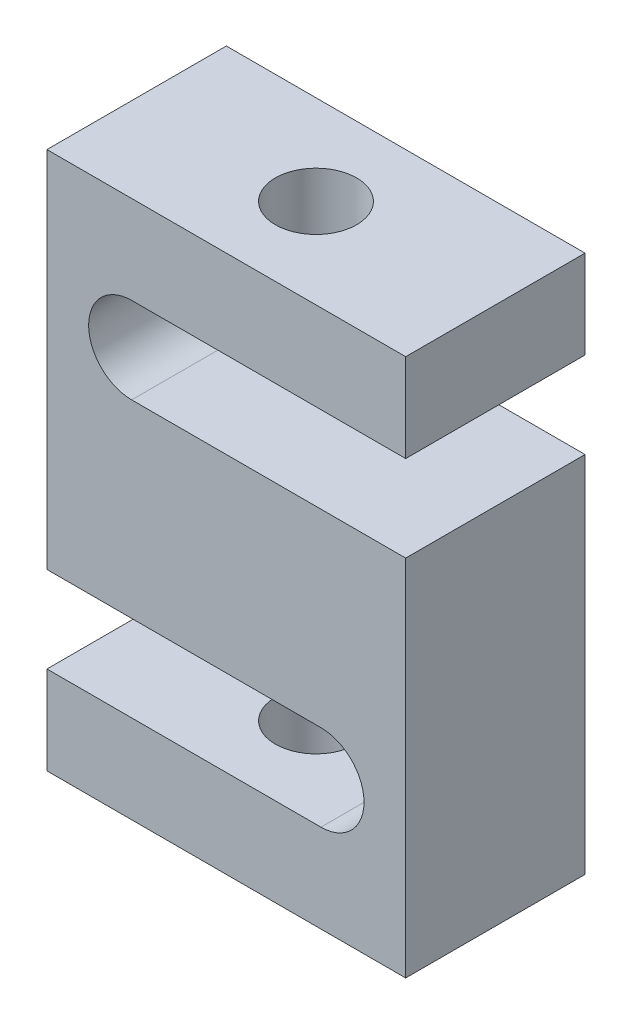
SolidWorks part; units mm, degrees
ref_plane "Front" through (0, 0, 0) normal (0, 0, 1) x (1, 0, 0)
ref_plane "Top" through (0, 0, 0) normal (0, 1, 0) x (1, 0, 0)
ref_plane "Right" through (0, 0, 0) normal (1, 0, 0) x (0, 0, -1)
sketch "Sketch2" plane through (0, 0, 0) normal (0, 0, 1) x (1, 0, 0)
  line L0 (-115.7484, 0) -> (180.4341, 0) construction
  line L1 (-25.4, 38.1) -> (25.4, 38.1)
  line L2 (-25.4, 38.1) -> (-25.4, -13.4)
  line L3 (-25.4, -38.1) -> (25.4, -38.1)
  line L4 (25.4, 38.1) -> (25.4, 25.6)
  line L5 (-25.4, 38.1) -> (25.4, -38.1) construction
  line L6 (-25.4, -38.1) -> (25.4, 38.1) construction
  line L7 (25.4, 25.6) -> (-13.4, 25.6)
  line L8 (-25.4, -13.4) -> (13.4, -13.4)
  line L9 (25.4, 13.4) -> (-13.4, 13.4)
  line L10 (-13.4, 25.6) -> (-13.4, 13.4) construction
  line L11 (25.4, 25.6) -> (-13.4, 13.4) construction
  line L12 (25.4, 13.4) -> (-13.4, 25.6) construction
  line L13 (25.4, 13.4) -> (25.4, -38.1)
  line L14 (13.4, -13.4) -> (13.4, -25.6) construction
  line L15 (13.4, -25.6) -> (-25.4, -25.6)
  line L16 (-25.4, -25.6) -> (-25.4, -38.1)
  arc A0 (-13.4, 25.6) -> (-13.4, 13.4) centre (-13.4, 19.5) ccw
  arc A1 (13.4, -25.6) -> (13.4, -13.4) centre (13.4, -19.5) ccw
  point P0 (0, 0)
  point P10 (6, 19.5)
extrude "Boss-Extrude1" add sketch "Sketch2" along normal mid plane 25.4
hole_wizard "1/2-20 Tapped Hole1" positions "Sketch3" profile "Sketch4" tap size "1/2-20" standard "ANSI Inch"
sketch "Sketch3" plane through (0, 38.1, 0) normal (0, 1, 0) x (1, 0, 0)
  point P0 (0, 0)
sketch "Sketch4" plane through (0, 38.1, 0) normal (1, 0, 0) x (0, 0, 1)
  line L0 (0, 0) -> (0, 51.5)
  line L1 (0, 51.5) -> (5.7544, 51.5)
  line L2 (5.7544, 51.5) -> (5.7544, 0)
  line L5 (5.7544, 0) -> (0, 0)
  line L11 (0, -6.35) -> (0, 107.95) construction
  dimension "Thru Tap Drill Dia." = 11.5087
  dimension "Thru Tap Drill Depth" = 51.5
mirror "Mirror1" about plane through (0, 0, 0) normal (0, 1, 0) of "1/2-20 Tapped Hole1"
equation "\"D7@Sketch2\"=\"D3@Sketch2\""
equation "\"D8@Sketch2\"=\"D4@Sketch2\""
equation "\"D6@Sketch2\"=\"D5@Sketch2\""
